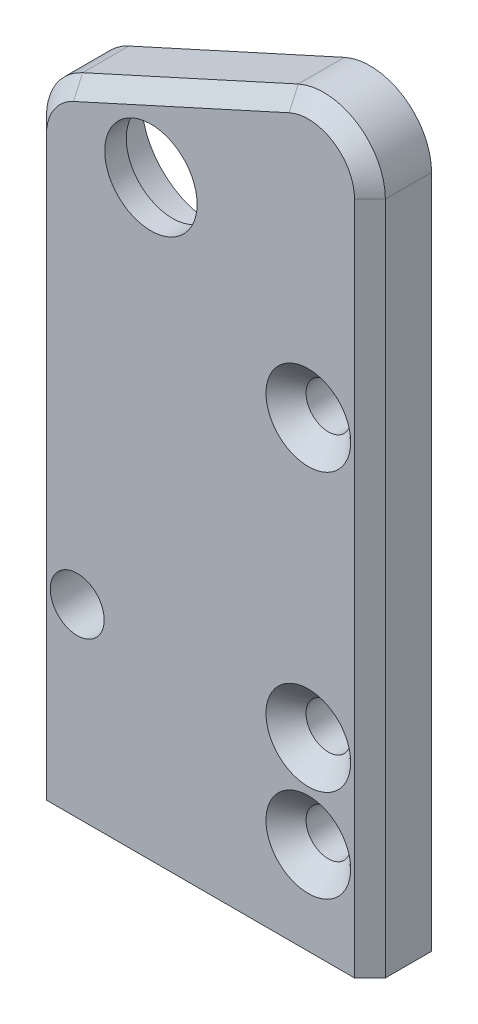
SolidWorks part; units mm, degrees
ref_plane "Plano frontal" through (0, 0, 0) normal (0, 0, 1) x (1, 0, 0)
ref_plane "Plano superior" through (0, 0, 0) normal (0, 1, 0) x (1, 0, 0)
ref_plane "Plano direito" through (0, 0, 0) normal (1, 0, 0) x (0, 0, -1)
sketch "Esboço1" plane through (0, 0, 0) normal (0, 0, 1) x (1, 0, 0)
  line L0 (0, 0) -> (22, 0)
  line L1 (22, 0) -> (22, 50)
  line L2 (22, 50) -> (0, 40)
  line L3 (0, 40) -> (0, 0)
  dimension "D1" = 40
  dimension "D2" = 50
  dimension "D3" = 22
extrude "Ressalto-extrusão1" add sketch "Esboço1" along normal blind 4
fillet "Filete1" radius 4 2 edges at (0, 40, 2) (22, 50, 2)
chamfer "Chanfro1" distance 1 angle 45 5 edges at (22, 21.894, 4) (20.1655, 47.1511, 4) (9.3448, 44.2476, 4) (0.6369, 39.5899, 4) (0, 18.7122, 4)
sketch "Esboço2" plane through (0, 0, 4) normal (0, 0, 1) x (1, 0, 0)
  line L0 (0, 0) -> (-10, 0) construction
  line L1 (-10, 0) -> (-10, 13) construction
  line L2 (-10, 13) -> (-41, 13) construction
  line L3 (-10, 13) -> (7.7809, 38.3937) construction
  line L4 (7.7809, 38.3937) -> (7.7809, 0) construction
  line L5 (1, 0) -> (21, 0) construction
  circle A0 centre (-10, 13) radius 31 construction
  dimension "D1" = 62
  dimension "D2" = 125
  dimension "D3" = 10
  dimension "D4" = 13
hole_wizard "Furo de diâmetro Ø6.0 (6)1" positions "3DSketch1" profile "Esboço3" hole size "Ø6.0" standard "ISO"
sketch3d "3DSketch1"
  point P0 (7.7809, 38.3937, 4)
sketch "Esboço3" plane through (7.7809, 38.3937, 4) normal (1, 0, 0) x (0, -1, 0)
  line L0 (0, 0) -> (0, 4)
  line L1 (0, 4) -> (3, 4)
  line L2 (3, 4) -> (3, 0)
  line L5 (3, 0) -> (0, 0)
  line L11 (0, -6.35) -> (0, 107.95) construction
  dimension "Thru Hole Dia." = 6
  dimension "Thru Hole Depth" = 4
sketch "Esboço6" plane through (0, 0, 4) normal (0, 0, 1) x (1, 0, 0)
  line L0 (18, 6) -> (18, 12) construction
  line L1 (1, 0) -> (21, 0) construction
  line L2 (22, 43.788) -> (22, 0) construction
  line L3 (18, 12) -> (3, 12) construction
  line L4 (0, 0) -> (0, 37.4243) construction
  point P0 (18, 6)
  point P1 (18, 12)
  dimension "D1" = 4
  dimension "D2" = 6
  dimension "D3" = 6
  dimension "D4" = 3
hole_wizard "Escareado para parafuso com cabeça escareada elevada de M2.51" positions "3DSketch3" profile "Esboço7" countersink size "M2.5" standard "ISO"
sketch3d "3DSketch3"
  point P0 (18, 6, 4)
  point P3 (18, 12, 4)
sketch "Esboço7" plane through (18, 6, 4) normal (1, 0, 0) x (0, -1, 0)
  line L0 (0, 0) -> (0, 4)
  line L1 (0, 4) -> (1.45, 4)
  line L2 (1.45, 4) -> (1.45, 1.3)
  line L3 (1.45, 1.3) -> (2.75, 0)
  line L5 (2.75, 0) -> (0, 0)
  line L6 (-1.45, 1.3) -> (-2.75, 0) construction
  line L11 (0, -6.35) -> (0, 107.95) construction
  dimension "Thru Hole Dia." = 2.9
  dimension "Thru Hole Depth" = 4
  dimension "Near C'Sink Dia." = 5.5
  dimension "Near C'Sink Angle" = 90
sketch "Esboço8" plane through (0, 0, 0) normal (0, -1, 0) x (1, 0, 0)
  line L0 (0, 0) -> (0, 4) construction
  line L1 (0, 2) -> (22, 2) construction
  line L2 (22, 3) -> (22, 0) construction
  point P7 (8, 2)
  point P8 (4, 2)
  point P9 (12, 2)
  dimension "D1" = 4
  dimension "D2" = 4
  dimension "D3" = 4
  dimension "D4" = 4
hole_wizard "Broca de rosquear para tarraxa de M21" positions "3DSketch4" profile "Esboço9" hole size "M2" standard "ISO"
sketch3d "3DSketch4"
  point P3 (4, 0, 2)
  point P7 (12, 0, 2)
sketch "Esboço9" plane through (4, 0, 2) normal (1, 0, 0) x (0, 0, -1)
  line L0 (0, 0) -> (0, 10.4807)
  line L1 (0, 10.4807) -> (0.8, 10)
  line L2 (0.8, 10) -> (0.8, 0)
  line L5 (0.8, 0) -> (0, 0)
  line L10 (0, 10.4807) -> (-0.8, 10) construction
  line L11 (0, -6.35) -> (0, 107.95) construction
  dimension "Hole Dia." = 1.6
  dimension "Hole Depth" = 10
  dimension "Drill Angle" = 118
sketch "Esboço10" plane through (0, 0, 0) normal (0, 0, -1) x (-1, 0, 0)
  circle A0 centre (-7.7809, 38.3937) radius 3 construction
  circle A1 centre (-7.7809, 38.3937) radius 4.6
  point P0 (-7.7809, 38.3937)
  dimension "D1" = 9.2
sketch "Esboço14" plane through (0, 0, 4) normal (0, 0, 1) x (1, 0, 0)
  line L0 (22, 43.788) -> (22, 0) construction
  line L1 (0, 0) -> (22, 0) construction
  point P0 (18, 30)
  dimension "D1" = 4
  dimension "D2" = 30
hole_wizard "Escareado para parafuso com cabeça escareada chata de M2.51" positions "3DSketch6" profile "Esboço15" countersink size "M2.5" standard "ISO"
sketch3d "3DSketch6"
  point P0 (18, 30, 4)
sketch "Esboço15" plane through (18, 30, 4) normal (1, 0, 0) x (0, -1, 0)
  line L0 (0, 0) -> (0, 4.8712)
  line L1 (0, 4.8712) -> (1.45, 4)
  line L2 (1.45, 4) -> (1.45, 1.3)
  line L3 (1.45, 1.3) -> (2.75, 0)
  line L5 (2.75, 0) -> (0, 0)
  line L6 (-1.45, 1.3) -> (-2.75, 0) construction
  line L10 (0, 4.8712) -> (-1.45, 4) construction
  line L11 (0, -6.35) -> (0, 107.95) construction
  dimension "Hole Dia." = 2.9
  dimension "Hole Depth" = 4
  dimension "Near C'Sink Dia." = 5.5
  dimension "Near C'Sink Angle" = 90
  dimension "Drill Angle" = 118
extrude "Corte-extrusão1" cut sketch "Esboço10" against normal blind 2.6
hole_wizard "Furo de diâmetro Ø3.5 (3.5)1" positions "3DSketch7" profile "Esboço16" hole size "Ø3.5" standard "ISO"
sketch3d "3DSketch7"
  point P0 (3, 12, 4)
sketch "Esboço16" plane through (3, 12, 4) normal (1, 0, 0) x (0, -1, 0)
  line L0 (0, 0) -> (0, 4)
  line L1 (0, 4) -> (1.75, 4)
  line L2 (1.75, 4) -> (1.75, 0)
  line L5 (1.75, 0) -> (0, 0)
  line L11 (0, -6.35) -> (0, 107.95) construction
  dimension "Thru Hole Dia." = 3.5
  dimension "Thru Hole Depth" = 4
